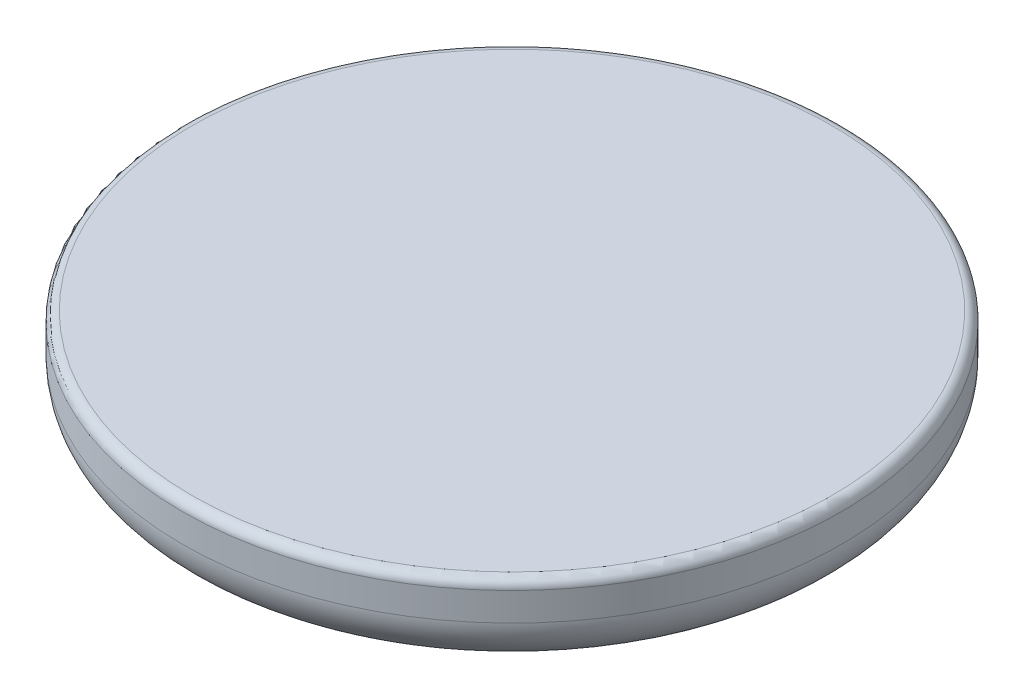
SolidWorks part; units mm, degrees
ref_plane "Front Plane" through (0, 0, 0) normal (0, 0, 1) x (1, 0, 0)
ref_plane "Top Plane" through (0, 0, 0) normal (0, 1, 0) x (1, 0, 0)
ref_plane "Right Plane" through (0, 0, 0) normal (1, 0, 0) x (0, 0, -1)
sketch "Sketch1" plane through (0, 0, 0) normal (0, 1, 0) x (1, 0, 0)
  circle A0 centre (0, 0) radius 35
extrude "Boss-Extrude1" add sketch "Sketch1" along normal blind 9
fillet "Fillet1" radius 5 1 edges at (0, 0, 35)
fillet "Fillet2" radius 1 1 edges at (0, 9, 35)
